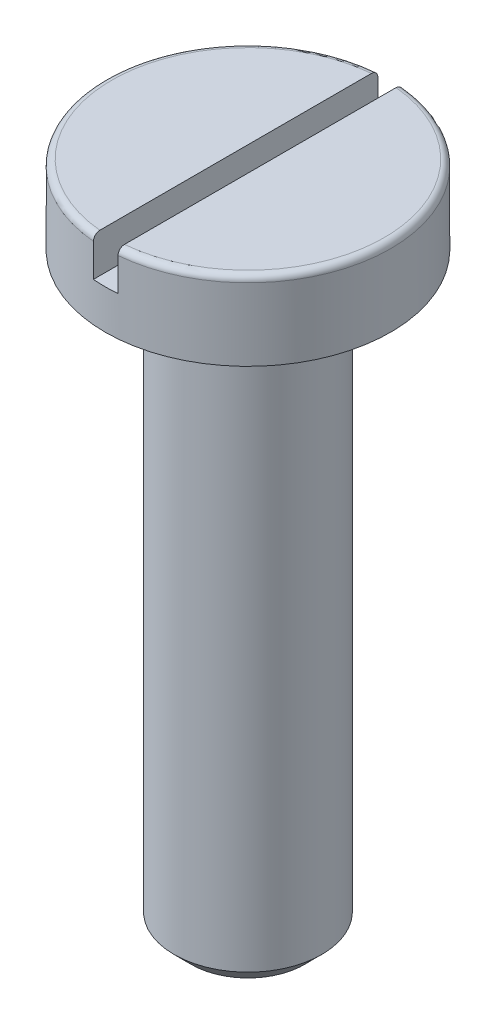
SolidWorks part; units mm, degrees
ref_plane "Face" through (0, 0, 0) normal (0, 0, 1) x (1, 0, 0)
ref_plane "Dessus" through (0, 0, 0) normal (0, 1, 0) x (1, 0, 0)
ref_plane "Droite" through (0, 0, 0) normal (1, 0, 0) x (0, 0, -1)
sketch "Esquisse1" plane through (0, 0, 0) normal (0, 1, 0) x (1, 0, 0)
  circle A0 centre (0, 0) radius 1.5
  dimension "Diamètre nominal" = 3
extrude "Base-Extrusion" add sketch "Esquisse1" against normal blind 12
chamfer "Chanfrein1" distance 0.35 angle 45 1 edges at (0, -12, 1.5)
sketch "Esquisse2" plane through (0, 0, 0) normal (0, 0, 1) x (1, 0, 0)
  line L0 (0, 1.6) -> (0, 0)
  line L2 (0, 0) -> (2.9, 0)
  line L4 (0, 1.6) -> (2.77, 1.6)
  line L5 (2.9, 0) -> (2.9, 1.47)
  line L7 (0, 1.3) -> (0, -12) construction
  line L8 (0, -11.65) -> (0, 0) construction
  line L9 (-1.15, -12) -> (1.15, -12) construction
  arc A0 (2.9, 1.47) -> (2.77, 1.6) centre (2.77, 1.47) ccw
  dimension "D2" = 0.13
  dimension "D1" = 5.8
  dimension "Hauteur tête" = 1.6
revolve "Boss.-Révol.1" add sketch "Esquisse2" angle 360 about L7
sketch "Esquisse3" plane through (0, 1.6, 0) normal (0, 1, 0) x (-1, 0, 0)
  line L0 (0, -2.9) -> (0, 2.9) construction
  line L1 (0.25, -2.9) -> (-0.25, -2.9)
  line L2 (0.25, 2.9) -> (-0.25, 2.9)
  line L3 (0.25, -2.9) -> (0.25, 2.9)
  line L4 (-0.25, -2.9) -> (-0.25, 2.9)
  circle A0 centre (0, 0) radius 2.9 construction
  dimension "Largeur fente" = 0.5
extrude "Enlèv. mat.-Extru.1" cut sketch "Esquisse3" against normal blind 0.8
